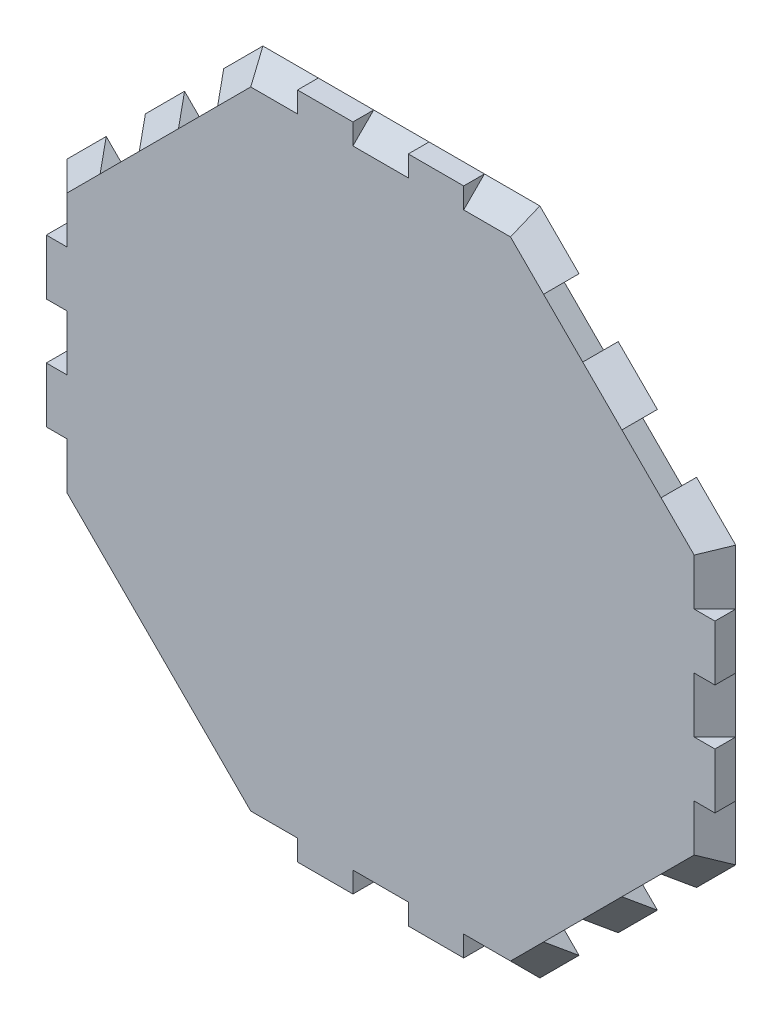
SolidWorks part; units mm, degrees
ref_plane "Alzado" through (0, 0, 0) normal (0, 0, 1) x (1, 0, 0)
ref_plane "Planta" through (0, 0, 0) normal (0, 1, 0) x (1, 0, 0)
ref_plane "Vista lateral" through (0, 0, 0) normal (1, 0, 0) x (0, 0, -1)
sketch "Croquis1" plane through (0, 0, 0) normal (0, 0, 1) x (1, 0, 0)
  line L1 (48.2843, 20) -> (20, 48.2843)
  line L2 (20, 48.2843) -> (-20, 48.2843)
  line L3 (-20, 48.2843) -> (-48.2843, 20)
  line L4 (-48.2843, 20) -> (-48.2843, -20)
  line L5 (-48.2843, -20) -> (-20, -48.2843)
  line L6 (-20, -48.2843) -> (20, -48.2843)
  line L7 (20, -48.2843) -> (48.2843, -20)
  line L8 (48.2843, -20) -> (48.2843, 20)
  circle A0 centre (0, 0) radius 48.2843 construction
  dimension "D1" = 40
extrude "Saliente-Extruir1" add sketch "Croquis1" along normal blind 3
chamfer "Chaflán1" distance 3 angle 45 8 edges at (-34.1421, -34.1421, 3) (-48.2843, 0, 3) (0, -48.2843, 3) (34.1421, -34.1421, 3) (48.2843, 0, 3) (34.1421, 34.1421, 3) (0, 48.2843, 3) (-34.1421, 34.1421, 3)
sketch "Croquis3" plane through (0, 0, 0) normal (0, 0, -1) x (-1, 0, 0)
  line L1 (-20, 48.2843) -> (20, 48.2843) construction
  line L3 (4, 48.2843) -> (4, 45.2843)
  line L4 (4, 45.2843) -> (12, 45.2843)
  line L5 (12, 45.2843) -> (12, 48.2843)
  line L6 (12, 48.2843) -> (4, 48.2843)
  line L7 (-4, 48.2843) -> (-4, 45.2843)
  line L8 (-4, 45.2843) -> (-12, 45.2843)
  line L9 (-12, 45.2843) -> (-12, 48.2843)
  line L10 (-12, 48.2843) -> (-4, 48.2843)
  line L11 (-12, -48.2843) -> (-4, -48.2843)
  line L12 (-12, -45.2843) -> (-12, -48.2843)
  line L13 (-4, -45.2843) -> (-12, -45.2843)
  line L14 (-4, -48.2843) -> (-4, -45.2843)
  line L15 (12, -48.2843) -> (4, -48.2843)
  line L16 (12, -45.2843) -> (12, -48.2843)
  line L17 (4, -45.2843) -> (12, -45.2843)
  line L18 (4, -48.2843) -> (4, -45.2843)
  line L20 (-48.2843, 4) -> (-45.2843, 4)
  line L21 (-45.2843, 4) -> (-45.2843, 12)
  line L22 (-45.2843, 12) -> (-48.2843, 12)
  line L23 (-48.2843, 12) -> (-48.2843, 4)
  line L24 (-48.2843, -4) -> (-45.2843, -4)
  line L25 (-45.2843, -4) -> (-45.2843, -12)
  line L26 (-45.2843, -12) -> (-48.2843, -12)
  line L27 (-48.2843, -12) -> (-48.2843, -4)
  line L28 (48.2843, -12) -> (48.2843, -4)
  line L29 (45.2843, -12) -> (48.2843, -12)
  line L30 (45.2843, -4) -> (45.2843, -12)
  line L31 (48.2843, -4) -> (45.2843, -4)
  line L32 (48.2843, 12) -> (48.2843, 4)
  line L33 (45.2843, 12) -> (48.2843, 12)
  line L34 (45.2843, 4) -> (45.2843, 12)
  line L35 (48.2843, 4) -> (45.2843, 4)
extrude "Saliente-Extruir2" add sketch "Croquis3" against normal blind 3
sketch "Croquis4" plane through (0, 0, 0) normal (0, 0, -1) x (-1, 0, 0)
  line L1 (-48.2843, 20) -> (-20, 48.2843) construction
  line L3 (-31.3137, 36.9706) -> (-29.1924, 34.8492)
  line L4 (-29.1924, 34.8492) -> (-23.5355, 40.5061)
  line L5 (-23.5355, 40.5061) -> (-25.6569, 42.6274)
  line L6 (-25.6569, 42.6274) -> (-31.3137, 36.9706)
  line L7 (-36.9706, 31.3137) -> (-34.8492, 29.1924)
  line L8 (-34.8492, 29.1924) -> (-40.5061, 23.5355)
  line L9 (-40.5061, 23.5355) -> (-42.6274, 25.6569)
  line L10 (-42.6274, 25.6569) -> (-36.9706, 31.3137)
  line L11 (-42.6274, -25.6569) -> (-36.9706, -31.3137)
  line L12 (-40.5061, -23.5355) -> (-42.6274, -25.6569)
  line L13 (-34.8492, -29.1924) -> (-40.5061, -23.5355)
  line L14 (-36.9706, -31.3137) -> (-34.8492, -29.1924)
  line L15 (-25.6569, -42.6274) -> (-31.3137, -36.9706)
  line L16 (-23.5355, -40.5061) -> (-25.6569, -42.6274)
  line L17 (-29.1924, -34.8492) -> (-23.5355, -40.5061)
  line L18 (-31.3137, -36.9706) -> (-29.1924, -34.8492)
  line L20 (31.3137, -36.9706) -> (29.1924, -34.8492)
  line L21 (29.1924, -34.8492) -> (23.5355, -40.5061)
  line L22 (23.5355, -40.5061) -> (25.6569, -42.6274)
  line L23 (25.6569, -42.6274) -> (31.3137, -36.9706)
  line L24 (36.9706, -31.3137) -> (34.8492, -29.1924)
  line L25 (34.8492, -29.1924) -> (40.5061, -23.5355)
  line L26 (40.5061, -23.5355) -> (42.6274, -25.6569)
  line L27 (42.6274, -25.6569) -> (36.9706, -31.3137)
  line L28 (42.6274, 25.6569) -> (36.9706, 31.3137)
  line L29 (40.5061, 23.5355) -> (42.6274, 25.6569)
  line L30 (34.8492, 29.1924) -> (40.5061, 23.5355)
  line L31 (36.9706, 31.3137) -> (34.8492, 29.1924)
  line L32 (25.6569, 42.6274) -> (31.3137, 36.9706)
  line L33 (23.5355, 40.5061) -> (25.6569, 42.6274)
  line L34 (29.1924, 34.8492) -> (23.5355, 40.5061)
  line L35 (31.3137, 36.9706) -> (29.1924, 34.8492)
extrude "Cortar-Extruir1" cut sketch "Croquis4" against normal blind 3
